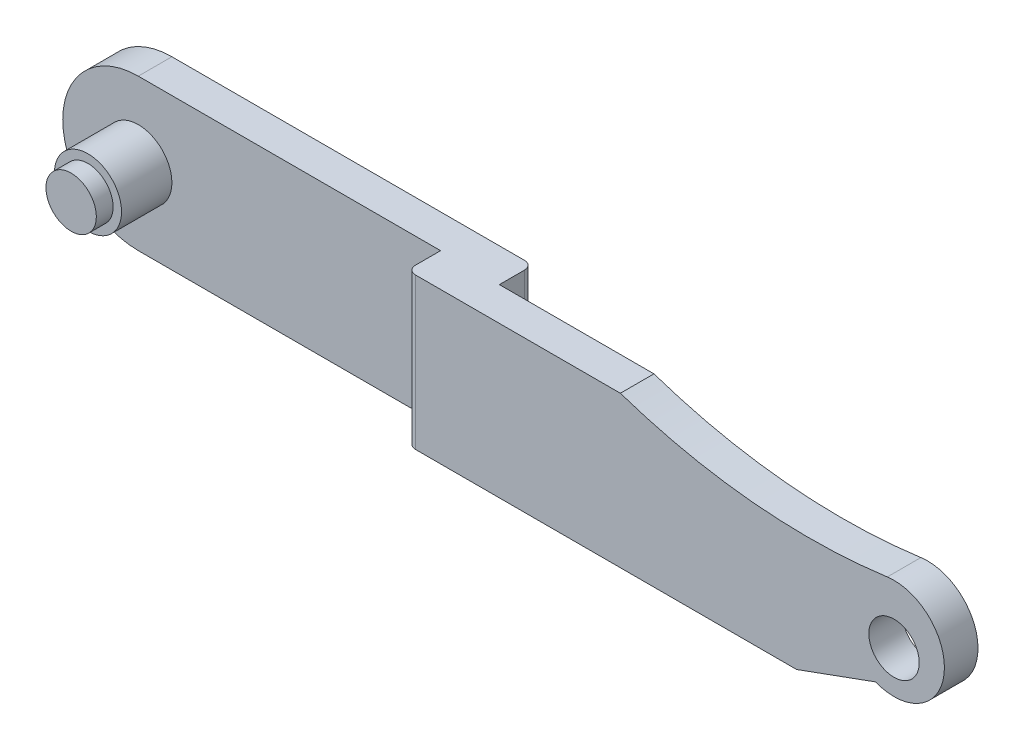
SolidWorks part; units mm, degrees
ref_plane "Face" through (0, 0, 0) normal (0, 0, 1) x (1, 0, 0)
ref_plane "Dessus" through (0, 0, 0) normal (0, 1, 0) x (1, 0, 0)
ref_plane "Droite" through (0, 0, 0) normal (1, 0, 0) x (0, 0, -1)
sketch "Esquisse1" plane through (0, 0, 0) normal (0, 0, 1) x (1, 0, 0)
  line L0 (0, 0) -> (21.5, 0)
  line L1 (21.5, 0) -> (21.5, -9)
  line L2 (21.5, -9) -> (0, -9)
  arc A0 (0, 0) -> (0, -9) centre (0, -4.5) ccw
  dimension "D1" = 9
  dimension "D2" = 21.5
extrude "Extrusion1" add sketch "Esquisse1" along normal blind 2
sketch "Esquisse2" plane through (0, 0, 2) normal (0, 0, 1) x (1, 0, 0)
  line L0 (18, 0) -> (30.7039, 0)
  line L1 (21.5, 0) -> (0, 0) construction
  line L3 (41.2, -9) -> (18, -9)
  line L4 (0, -9) -> (21.5, -9) construction
  line L5 (18, 0) -> (18, -9)
  line L6 (21.5, -9) -> (21.5, 0) construction
  line L7 (41.2, -9) -> (45.8977, -7.2902)
  arc A0 (30.7039, 0) -> (46.5982, -1.527) centre (41.91, 33.1576) ccw
  arc A1 (45.8977, -7.2902) -> (46.5982, -1.527) centre (47, -4.5) ccw
  point P11 (47, -5)
  point P12 (41.91, 33.1576)
  dimension "D6" = 70
  dimension "D8" = 6
  dimension "D1" = 3.5
  dimension "D2" = 47
  dimension "D3" = 0.5
  dimension "D4" = 23.91
  dimension "D7" = 47
  dimension "D9" = 23.2
  dimension "D10" = 160
extrude "Extrusion2" add sketch "Esquisse2" along normal blind 2
sketch "Esquisse3" plane through (0, 0, 4) normal (0, 0, 1) x (1, 0, 0)
  circle A0 centre (47, -5) radius 1.5
  dimension "D1" = 3
extrude "Enlèv. mat.-Extru.1" cut sketch "Esquisse3" against normal through all
sketch "Esquisse4" plane through (0, 0, 2) normal (0, 0, 1) x (1, 0, 0)
  circle A0 centre (0, -4.5) radius 2
  dimension "D1" = 4
extrude "Extrusion3" add sketch "Esquisse4" along normal blind 3
sketch "Esquisse5" plane through (0, 0, 5) normal (0, 0, 1) x (1, 0, 0)
  circle A0 centre (0, -4.5) radius 1.5
  dimension "D1" = 3
extrude "Extrusion4" add sketch "Esquisse5" along normal blind 1
sketch "Esquisse6" plane through (0, 0, 0) normal (0, 0, -1) x (-1, 0, 0)
  circle A0 centre (0, -4.5) radius 2
  arc A1 (0, -9) -> (0, 0) centre (0, -4.5) ccw construction
  dimension "D1" = 4
extrude "Extrusion5" add sketch "Esquisse6" along normal blind 2
sketch "Esquisse7" plane through (0, 0, -2) normal (0, 0, -1) x (-1, 0, 0)
  circle A0 centre (0, -4.5) radius 1.5
  circle A1 centre (0, -4.5) radius 2 construction
  dimension "D1" = 3
extrude "Extrusion6" add sketch "Esquisse7" along normal blind 1
fillet "Congé1" radius 0.5 2 edges at (21.5, -4.5, 0) (18, -4.5, 4)
